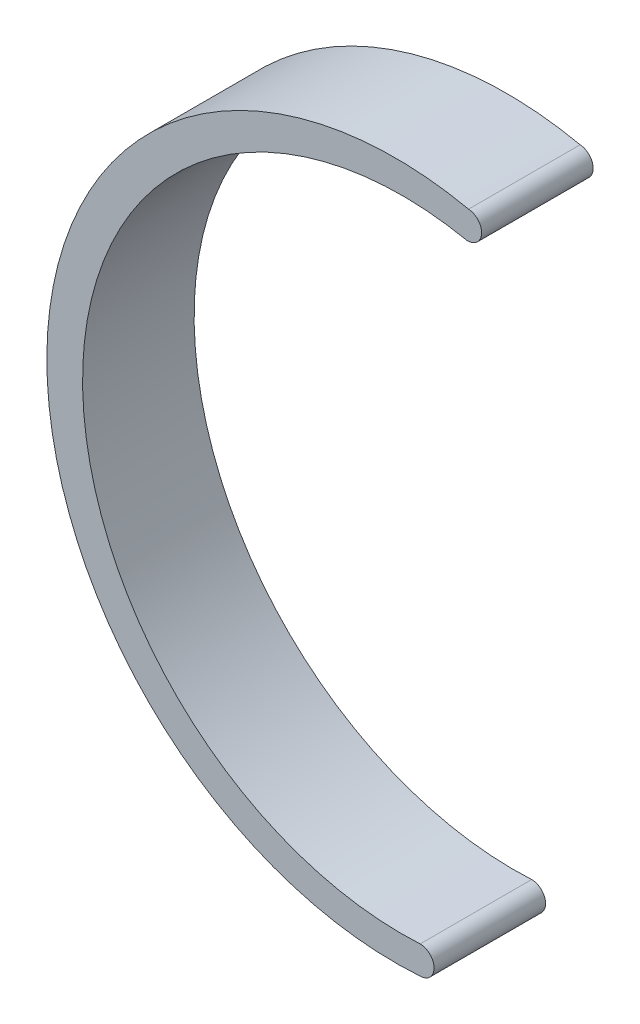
SolidWorks part; units mm, degrees
ref_plane "Front Plane" through (0, 0, 0) normal (0, 0, 1) x (1, 0, 0)
ref_plane "Top Plane" through (0, 0, 0) normal (0, 1, 0) x (1, 0, 0)
ref_plane "Right Plane" through (0, 0, 0) normal (1, 0, 0) x (0, 0, -1)
sketch "Sketch1" plane through (0, 0, 0) normal (0, 0, 1) x (1, 0, 0)
  line L0 (-2.8311, -95.01) -> (-2.8311, 132.3768) construction
  line L1 (-2.8311, -95.01) -> (13.7614, 140.5244) construction
  line L3 (82.6514, 0) -> (-146.7002, 0) construction
  arc A0 (10.4223, 93.1242) -> (-2.8311, -95.01) centre (-9.5889, 0) ccw
  arc A1 (-2.8311, -87.39) -> (9.8855, 85.5042) centre (-7.6716, -0.1192) cw
  arc A2 (10.4223, 93.1242) -> (9.8855, 85.5042) centre (10.1539, 89.3142) cw
  arc A3 (-2.8311, -87.39) -> (-2.8311, -95.01) centre (-2.8311, -91.2) cw
  dimension "D1" = 7.62
  dimension "D2" = 95.25
  dimension "D3" = 7.62
extrude "Boss-Extrude1" add sketch "Sketch1" along normal blind 30.48 contours A1 A2 A0 A3
